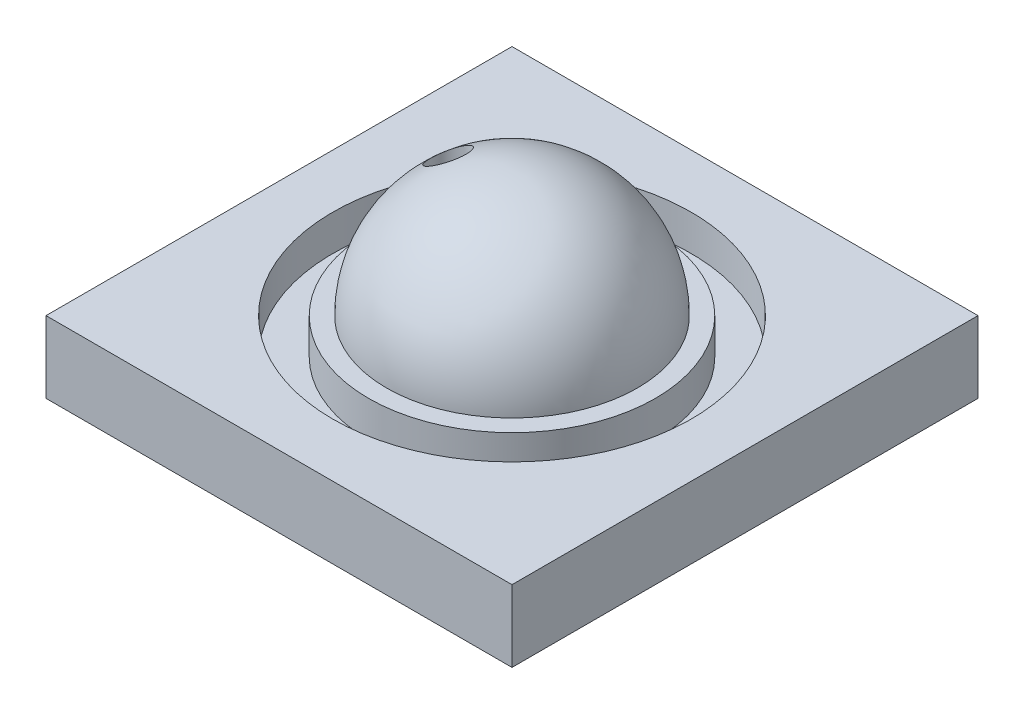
SolidWorks part; units mm, degrees
ref_plane "Front Plane" through (0, 0, 0) normal (0, 0, 1) x (1, 0, 0)
ref_plane "Top Plane" through (0, 0, 0) normal (0, 1, 0) x (1, 0, 0)
ref_plane "Right Plane" through (0, 0, 0) normal (1, 0, 0) x (0, 0, -1)
sketch "Sketch1" plane through (0, 0, 0) normal (0, 0, 1) x (1, 0, 0)
  line L0 (7, 0) -> (0, 0)
  line L1 (0, 0) -> (0, 7)
  arc A0 (0, 7) -> (7, 0) centre (0, 0) cw
revolve "Revolve1" add sketch "Sketch1" angle 360 about L1
sketch "Sketch2" plane through (0, 0, 0) normal (0, 1, 0) x (1, 0, 0)
  line L1 (-13, -13) -> (13, -13)
  line L2 (-13, -13) -> (-13, 13)
  line L3 (-13, 13) -> (13, 13)
  line L4 (13, -13) -> (13, 13)
  line L5 (-13, -13) -> (13, 13) construction
  line L6 (-13, 13) -> (13, -13) construction
  point P0 (0, 0)
extrude "Boss-Extrude1" add sketch "Sketch2" against normal blind 4
sketch "Sketch3" plane through (0, 0, 0) normal (0, 1, 0) x (1, 0, 0)
  circle A0 centre (0, 0) radius 8
  circle A1 centre (0, 0) radius 10
extrude "Cut-Extrude1" cut sketch "Sketch3" against normal blind 2
sketch "Sketch4" plane through (0, 0, 0) normal (0, 1, 0) x (1, 0, 0)
  circle A0 centre (-3.5672, 0) radius 1
extrude "Cut-Extrude2" cut sketch "Sketch4" along normal blind 12
